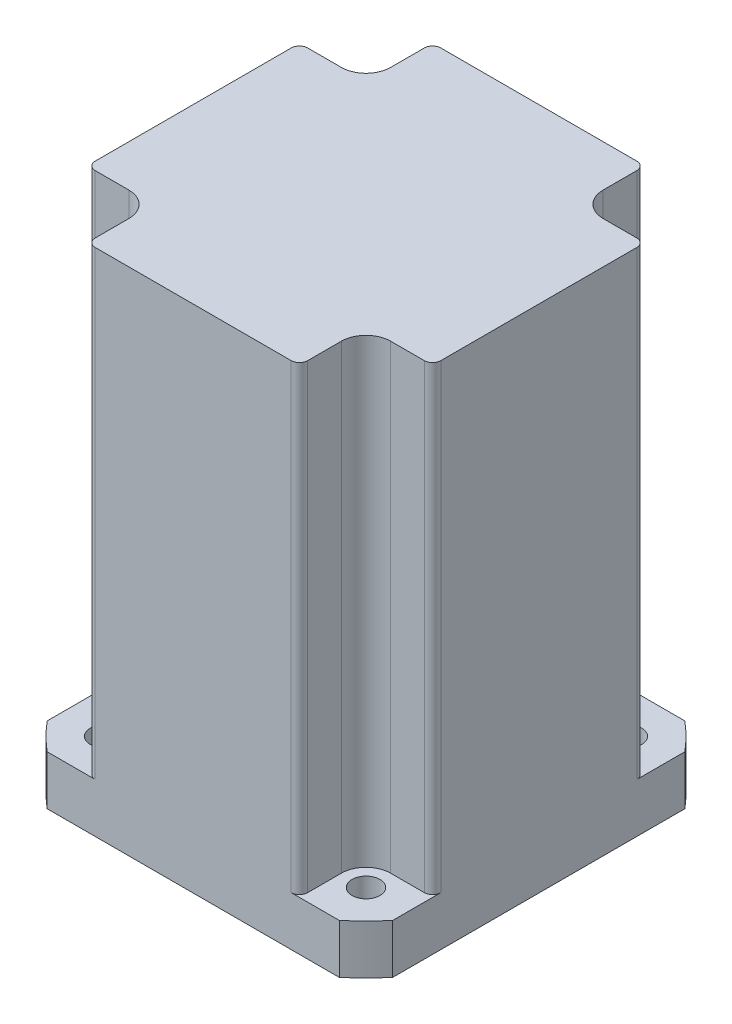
SolidWorks part; units mm, degrees
ref_plane "Front Plane" through (0, 0, 0) normal (0, 0, 1) x (1, 0, 0)
ref_plane "Top Plane" through (0, 0, 0) normal (0, 1, 0) x (1, 0, 0)
ref_plane "Right Plane" through (0, 0, 0) normal (1, 0, 0) x (0, 0, -1)
ref_plane "Plane1" through (-12.9099, 0, 0) normal (-1, 0, 0) x (0, -1, 0)
sketch "Sketch1" plane through (-12.9099, 0, 0) normal (-1, 0, 0) x (0, -1, 0)
  line L0 (-62, -12.9099) -> (-6, -12.9099)
  line L1 (-6, -12.9099) -> (-6, 21)
  line L2 (-6, 21) -> (-62, 21)
  line L3 (-62, 21) -> (-62, -12.9099)
extrude "Boss-Extrude1" add sketch "Sketch1" against normal blind 25.8198
sketch "Sketch2" plane through (12.9099, 0, 0) normal (1, 0, 0) x (0, 0, -1)
  line L0 (12.9099, 6) -> (-12.9099, 6)
  line L1 (-12.9099, 6) -> (-12.9099, 62)
  line L2 (-12.9099, 62) -> (12.9099, 62)
  line L3 (12.9099, 62) -> (12.9099, 6)
extrude "Boss-Extrude2" add sketch "Sketch2" along normal blind 8.0901
sketch "Sketch3" plane through (0, 0, -12.9099) normal (0, 0, -1) x (-1, 0, 0)
  line L0 (12.9099, 6) -> (-12.9099, 6)
  line L1 (-12.9099, 6) -> (-12.9099, 62)
  line L2 (-12.9099, 62) -> (12.9099, 62)
  line L3 (12.9099, 62) -> (12.9099, 6)
extrude "Boss-Extrude3" add sketch "Sketch3" along normal blind 8.0901
sketch "Sketch4" plane through (-12.9099, 0, 0) normal (-1, 0, 0) x (0, 0, 1)
  line L0 (12.9099, 6) -> (-12.9099, 6)
  line L1 (-12.9099, 6) -> (-12.9099, 62)
  line L2 (-12.9099, 62) -> (12.9099, 62)
  line L3 (12.9099, 62) -> (12.9099, 6)
extrude "Boss-Extrude4" add sketch "Sketch4" along normal blind 8.0901
sketch "Sketch5" plane through (0, 6, 0) normal (0, -1, 0) x (1, 0, 0)
  line L0 (-21, -17.7553) -> (-21, 17.7553)
  line L1 (-17.7553, 21) -> (17.7553, 21)
  line L2 (21, 17.7553) -> (21, -17.7553)
  line L3 (17.7553, -21) -> (-17.7553, -21)
  arc A0 (-17.7553, -21) -> (-21, -17.7553) centre (0, 0) cw
  arc A1 (-21, 17.7553) -> (-17.7553, 21) centre (0, 0) cw
  arc A2 (17.7553, 21) -> (21, 17.7553) centre (0, 0) cw
  arc A3 (21, -17.7553) -> (17.7553, -21) centre (0, 0) cw
extrude "Boss-Extrude5" add sketch "Sketch5" along normal blind 6
hole_wizard "Ø3.4 (3.4) Diameter Hole1" positions "Sketch7" profile "Sketch6" hole size "Ø3.4" standard "Ansi Metric"
sketch "Sketch7" plane through (0, 0, 0) normal (0, -1, 0) x (1, 0, 0)
  point P0 (15.9099, -15.9099)
  point P1 (-15.9099, -15.9099)
  point P2 (-15.9099, 15.9099)
  point P3 (15.9099, 15.9099)
sketch "Sketch6" plane through (15.9099, 0, -15.9099) normal (1, 0, 0) x (0, 0, -1)
  line L0 (0, 0) -> (0, 62.0001)
  line L1 (0, 62.0001) -> (1.7, 62.0001)
  line L2 (1.7, 62.0001) -> (1.7, 0)
  line L5 (1.7, 0) -> (0, 0)
  line L11 (0, -6.35) -> (0, 107.95) construction
  dimension "Thru Hole Dia." = 3.4
  dimension "Thru Hole Depth" = 62.0001
hole_wizard "Ø2.0 (2) Diameter Hole1" positions "Sketch9" profile "Sketch8" hole size "Ø2.0" standard "Ansi Metric"
sketch "Sketch9" plane through (-21, 0, 0) normal (-1, 0, 0) x (0, 0, 1)
  point P0 (-9.7, 50.8)
  point P1 (0, 50.8)
sketch "Sketch8" plane through (-21, 50.8, -9.7) normal (0, 1, 0) x (0, 0, 1)
  line L0 (0, 0) -> (0, 6)
  line L1 (0, 6) -> (1, 6)
  line L2 (1, 6) -> (1, 0)
  line L5 (1, 0) -> (0, 0)
  line L10 (0, 6) -> (-1, 6) construction
  line L11 (0, -6.35) -> (0, 107.95) construction
  dimension "Hole Dia." = 2
  dimension "Hole Depth" = 6
  dimension "Drill Angle" = 180
chamfer "Chamfer1" distance 0.2001 angle 44.997 2 edges at (-21, 50.8, 1) (-21, 50.8, -8.7)
fillet "Fillet1" radius 1 8 edges
fillet "Fillet2" radius 3 4 edges
